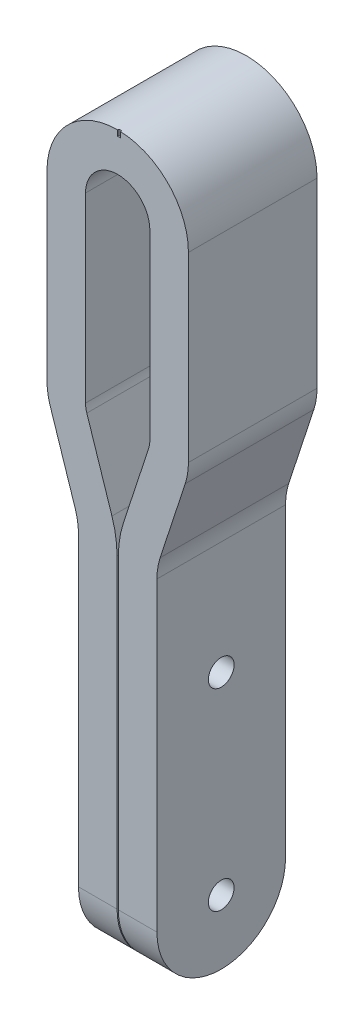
SolidWorks part; units mm, degrees
ref_plane "Frontal" through (0, 0, 0) normal (0, 0, 1) x (1, 0, 0)
ref_plane "Horizontal" through (0, 0, 0) normal (0, 1, 0) x (1, 0, 0)
ref_plane "Vertical" through (0, 0, 0) normal (1, 0, 0) x (0, 0, -1)
sketch "Esquisse1" plane through (0, 0, 0) normal (0, 0, 1) x (1, 0, 0)
  line L0 (3.05, 45.7325) -> (3.05, 75.3115)
  line L1 (3.05, 75.3115) -> (5.5, 82.7852)
  line L2 (5.5, 82.7852) -> (5.5, 97.7325)
  line L3 (0, 113.8296) -> (0, 0) construction
  line L4 (-5.5, 82.7852) -> (-5.5, 97.7325)
  line L5 (-3.05, 75.3115) -> (-5.5, 82.7852)
  line L6 (-3.05, 45.7325) -> (-3.05, 75.3115)
  arc A0 (5.5, 97.7325) -> (-5.5, 97.7325) centre (0, 97.7325) ccw
  point P12 (0, 103.2325)
  dimension "D3" = 52
  dimension "D1" = 6.1
  dimension "D2" = 11
extrude "Base-Extru.-Mince" add sketch "Esquisse1" along normal blind 10 thin
fillet "Congé1" radius 5 4 edges at (-3.05, 75.3115, 5) (-5.5, 82.7852, 5) (5.5, 82.7852, 5) (3.05, 75.3115, 5)
fillet "Congé2" radius 2 2 edges at (-2.5, 83.2644, 5) (2.5, 83.2644, 5)
fillet "Congé3" radius 8 2 edges at (0.05, 75.7907, 5) (-0.05, 75.7907, 5)
fillet "Congé4" radius 5 8 edges at (-1.55, 45.7325, 0) (1.55, 45.7325, 0) (-0.05, 45.7325, 5) (-3.05, 45.7325, 5) (3.05, 45.7325, 5) (0.05, 45.7325, 5) (-1.55, 45.7325, 10) (1.55, 45.7325, 10)
sketch "Esquisse2" plane through (3.05, 0, 0) normal (1, 0, 0) x (0, 0, -1)
  line L0 (-5, 41.8189) -> (-5, 88.0923) construction
  circle A0 centre (-5, 50.7325) radius 1
  arc A1 (-10, 50.7325) -> (-5, 45.7325) centre (-5, 50.7325) ccw construction
  circle A2 centre (-5, 65.7325) radius 1
  dimension "D1" = 2
  dimension "D3" = 2
  dimension "D2" = 15
extrude "Enlèv. mat.-Extru.1" cut sketch "Esquisse2" against normal through all
sketch "Esquisse4" plane through (0, 0, 10) normal (0, 0, 1) x (1, 0, 0)
  line L1 (0, 103.2325) -> (0.2118, 103.2325)
  line L2 (0, 103.2325) -> (0, 102.7991)
  line L3 (0, 102.7991) -> (0.2118, 102.7991)
  line L4 (0.2118, 103.2325) -> (0.2118, 102.7991)
  arc A0 (5.5, 97.7325) -> (-5.5, 97.7325) centre (0, 97.7325) ccw construction
extrude "Enlèv. mat.-Extru.3" cut sketch "Esquisse4" against normal blind 0.1
